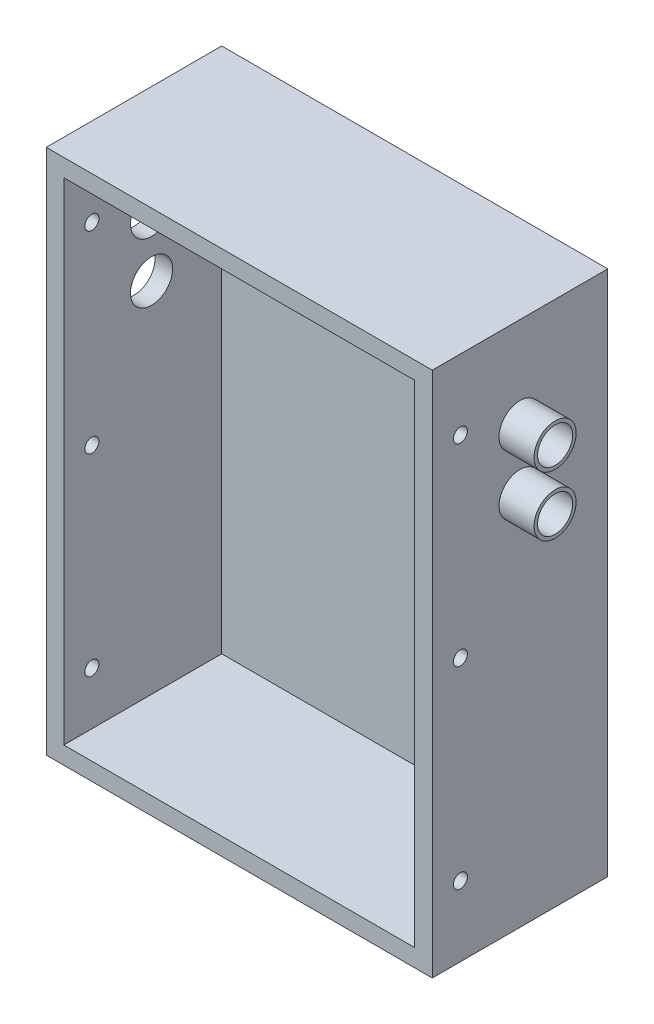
SolidWorks part; units mm, degrees
ref_plane "Alzado" through (0, 0, 0) normal (0, 0, 1) x (1, 0, 0)
ref_plane "Planta" through (0, 0, 0) normal (0, 1, 0) x (1, 0, 0)
ref_plane "Vista lateral" through (0, 0, 0) normal (1, 0, 0) x (0, 0, -1)
sketch "Croquis1" plane through (0, 0, 0) normal (0, 0, 1) x (1, 0, 0)
  line L1 (-55, 75) -> (55, 75)
  line L2 (-55, 75) -> (-55, -75)
  line L3 (-55, -75) -> (55, -75)
  line L4 (55, 75) -> (55, -75)
  line L5 (-55, 75) -> (55, -75) construction
  line L6 (-55, -75) -> (55, 75) construction
  point P0 (0, 0)
  dimension "D1" = 150
  dimension "D2" = 110
extrude "Saliente-Extruir1" add sketch "Croquis1" along normal blind 50
sketch "Croquis2" plane through (0, 0, 50) normal (0, 0, 1) x (1, 0, 0)
  line L1 (-50, 70) -> (50, 70)
  line L2 (-50, 70) -> (-50, -70)
  line L3 (-50, -70) -> (50, -70)
  line L4 (50, 70) -> (50, -70)
  line L5 (-50, 70) -> (50, -70) construction
  line L6 (-50, -70) -> (50, 70) construction
  point P0 (0, 0)
  dimension "D1" = 140
  dimension "D2" = 100
extrude "Cortar-Extruir1" cut sketch "Croquis2" against normal blind 45
sketch "Croquis4" plane through (-55, 0, 0) normal (-1, 0, 0) x (0, 0, 1)
  line L0 (25, 75) -> (25, -75) construction
  line L1 (50, 75) -> (0, 75) construction
  line L2 (50, -75) -> (0, -75) construction
  line L3 (0, 0) -> (50, 0) construction
  line L4 (0, 75) -> (0, -75) construction
  line L5 (50, 75) -> (50, -75) construction
  circle A0 centre (25, 49) radius 6
  circle A1 centre (25, 32) radius 6
  point P14 (25, 55)
  point P17 (25, 43)
  point P18 (25, 38)
  dimension "D1" = 12
  dimension "D3" = 12
  dimension "D2" = 20
  dimension "D4" = 5
extrude "Saliente-Extruir2" add sketch "Croquis4" along normal blind 10 and the other way blind 120
sketch "Croquis5" plane through (-65, 0, 0) normal (-1, 0, 0) x (0, 0, 1)
  circle A0 centre (25, 49) radius 5
  circle A1 centre (25, 32) radius 5
  dimension "D1" = 10
  dimension "D2" = 10
extrude "Cortar-Extruir2" cut sketch "Croquis5" against normal up to next and the other way through all
sketch "Croquis6" plane through (-55, 0, 0) normal (-1, 0, 0) x (0, 0, 1)
  line L0 (50, 75) -> (50, -75) construction
  line L1 (50, 75) -> (0, 75) construction
  line L2 (50, -75) -> (0, -75) construction
  circle A0 centre (42, 55) radius 2
  circle A1 centre (42, 0) radius 2
  circle A2 centre (42, -55) radius 2
  dimension "D1" = 4
  dimension "D2" = 4
  dimension "D3" = 4
  dimension "D4" = 8
  dimension "D5" = 8
  dimension "D6" = 8
  dimension "D7" = 20
  dimension "D8" = 20
  dimension "D9" = 55
extrude "Cortar-Extruir3" cut sketch "Croquis6" against normal through all both and the other way through all
sketch "Croquis7" plane through (0, 0, 5) normal (0, 0, 1) x (1, 0, 0)
  line L1 (-50, 75) -> (50, 75)
  line L2 (-50, 75) -> (-50, -75)
  line L3 (-50, -75) -> (50, -75)
  line L4 (50, 75) -> (50, -75)
  line L5 (-50, 75) -> (50, -75) construction
  line L6 (-50, -75) -> (50, 75) construction
  point P0 (0, 0)
  dimension "D1" = 150
  dimension "D2" = 100
extrude "Saliente-Extruir3" add sketch "Croquis7" along normal blind 45
sketch "Croquis8" plane through (0, 0, 50) normal (0, 0, 1) x (1, 0, 0)
  line L1 (-50, 70) -> (50, 70)
  line L2 (-50, 70) -> (-50, -70)
  line L3 (-50, -70) -> (50, -70)
  line L4 (50, 70) -> (50, -70)
  line L5 (-50, 70) -> (50, -70) construction
  line L6 (-50, -70) -> (50, 70) construction
  point P0 (0, 0)
  dimension "D1" = 100
  dimension "D2" = 140
extrude "Cortar-Extruir4" cut sketch "Croquis8" against normal blind 45
sketch "Croquis9" plane through (-65, 0, 0) normal (-1, 0, 0) x (0, 0, 1)
  circle A0 centre (25, 49) radius 6
  circle A1 centre (25, 32) radius 6
extrude "Cortar-Extruir5" cut sketch "Croquis9" against normal blind 15
